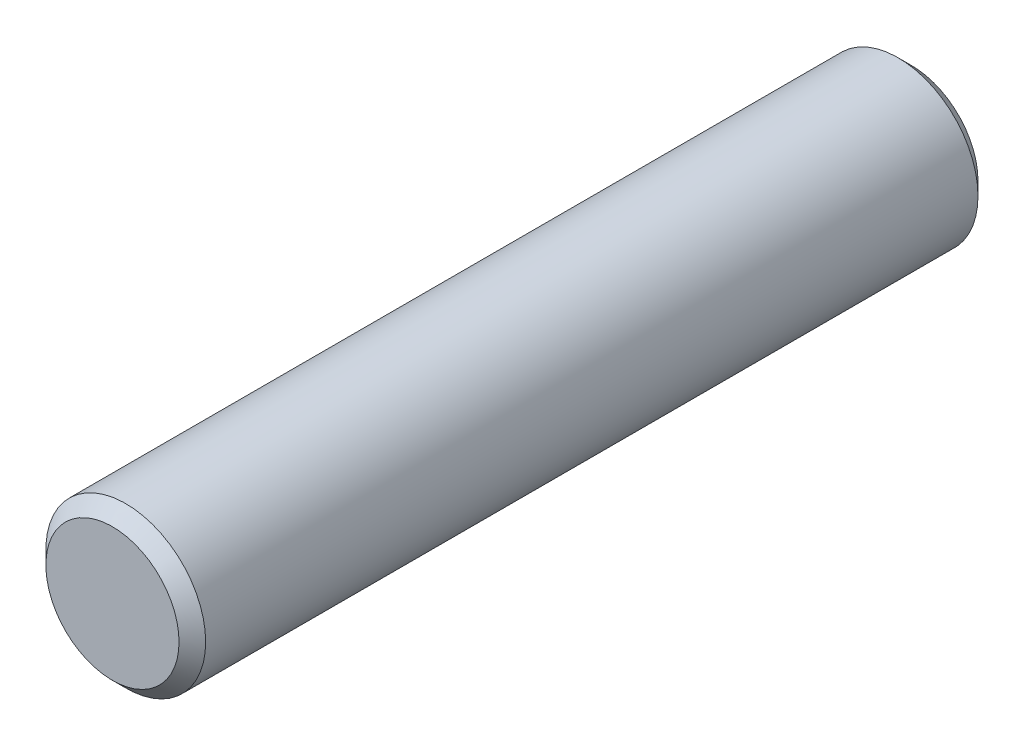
SolidWorks part; units mm, degrees
ref_plane "Plan1" through (0, 0, 0) normal (0, 0, 1) x (1, 0, 0)
ref_plane "Plan2" through (0, 0, 0) normal (0, 1, 0) x (1, 0, 0)
ref_plane "Plan3" through (0, 0, 0) normal (1, 0, 0) x (0, 0, -1)
sketch "Esquisse1" plane through (0, 0, 0) normal (0, 0, 1) x (1, 0, 0)
  circle A0 centre (0, 0) radius 3
  dimension "D1" = 6
extrude "Base-Extrusion" add sketch "Esquisse1" along normal blind 30
chamfer "Chanfrein1" distance 0.5 angle 45
